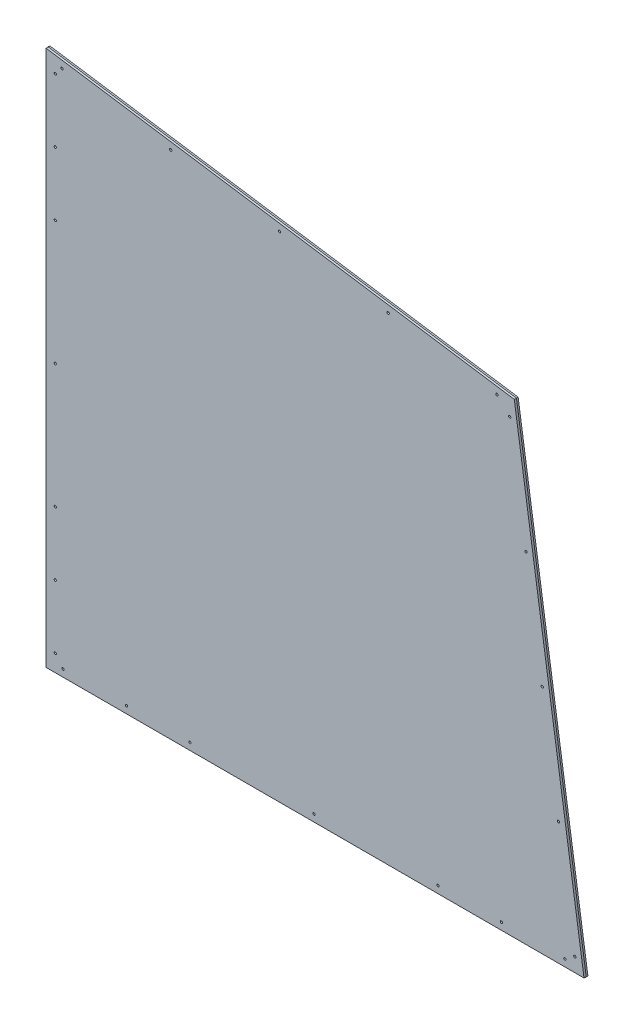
SolidWorks part; units mm, degrees
ref_plane "Front Plane" through (0, 0, 0) normal (0, 0, 1) x (1, 0, 0)
ref_plane "Top Plane" through (0, 0, 0) normal (0, 1, 0) x (1, 0, 0)
ref_plane "Right Plane" through (0, 0, 0) normal (1, 0, 0) x (0, 0, -1)
sketch "Sketch2" plane through (0, 0, 0) normal (0, 0, 1) x (1, 0, 0)
  line L0 (0, 4.3656) -> (0, 1212.85) construction
  line L1 (0, 1212.85) -> (1055.0672, 1055.0672) construction
  line L2 (1212.1971, 4.3656) -> (1055.0672, 1055.0672) construction
  line L3 (0, 4.3656) -> (1212.1971, 4.3656) construction
  line L4 (0, 4.3656) -> (0, 1212.85)
  line L5 (0, 1212.85) -> (1055.0672, 1055.0672)
  line L6 (1212.1971, 4.3656) -> (1055.0672, 1055.0672)
  line L7 (0, 4.3656) -> (1212.1971, 4.3656)
extrude "Boss-Extrude1" add sketch "Sketch2" along normal mid plane 8.7312
sketch "Sketch3" plane through (0, 0, 0) normal (-1, 0, 0) x (0, 0, 1)
  line L0 (0, 1212.85) -> (4.3656, 1212.1971)
  line L1 (4.3656, 1212.85) -> (-4.3656, 1212.85) construction
  line L2 (0, 1212.85) -> (-4.3656, 1212.1971)
  line L3 (-4.3656, 1212.1971) -> (-4.3656, 1215.39)
  line L4 (4.3656, 1212.1971) -> (4.3656, 1215.39)
  line L5 (4.3656, 1215.39) -> (-4.3656, 1215.39)
  line L6 (4.3656, 1212.85) -> (4.3656, 4.3656) construction
  line L7 (-4.3656, 1212.85) -> (-4.3656, 4.3656) construction
  line L8 (4.3656, 1212.1971) -> (1055.0672, 1055.0672) construction
  dimension "D1" = 2.54
  dimension "D2" = 8.505
extrude "Cut-Extrude1" cut sketch "Sketch3" along direction (-0.989, 0.1479, 0) on the side against the normal through all
sketch "Sketch4" plane through (0, 4.3656, 0) normal (0, -1, 0) x (1, 0, 0)
  line L0 (1212.1971, 0) -> (1211.5443, 4.3656)
  line L1 (1212.1971, 4.3656) -> (1212.1971, -4.3656) construction
  line L2 (1212.1971, 0) -> (1211.5443, -4.3656)
  line L3 (1211.5443, 4.3656) -> (1214.7371, 4.3656)
  line L4 (1211.5443, -4.3656) -> (1214.7371, -4.3656)
  line L5 (1214.7371, -4.3656) -> (1214.7371, 4.3656)
  line L6 (0, 4.3656) -> (1212.1971, 4.3656) construction
  line L7 (0, -4.3656) -> (1212.1971, -4.3656) construction
  line L8 (1212.85, 0) -> (1055.0672, 1055.0672) construction
  dimension "D1" = 2.54
  dimension "D2" = 8.505
extrude "Cut-Extrude2" cut sketch "Sketch4" along direction (-0.1479, 0.989, 0) on the side against the normal through all
sketch "Sketch5" plane through (0, 0, 4.3656) normal (0, 0, 1) x (1, 0, 0)
  line L0 (0, 20.2406) -> (38.1, 20.2406) construction
  line L1 (0, 1212.1971) -> (0, 4.3656) construction
  line L2 (20.6375, 4.3656) -> (20.6375, 42.4656) construction
  line L3 (0, 4.3656) -> (1211.5443, 4.3656) construction
  line L4 (38.1, 20.2406) -> (180.975, 20.2406) construction
  line L5 (20.6375, 42.4656) -> (20.6375, 185.3406) construction
  line L6 (20.6375, 185.3406) -> (20.6375, 328.2156) construction
  line L7 (180.975, 20.2406) -> (323.85, 20.2406) construction
  line L8 (323.85, 20.2406) -> (603.25, 20.2406) construction
  line L9 (603.25, 20.2406) -> (882.65, 20.2406) construction
  line L10 (20.6375, 328.2156) -> (20.6375, 607.6156) construction
  line L11 (20.6375, 607.6156) -> (20.6375, 887.0156) construction
  line L12 (20.6375, 887.0156) -> (20.6375, 1029.8906) construction
  line L13 (20.6375, 1029.8906) -> (20.6375, 1172.7656) construction
  line L14 (20.6375, 1172.7656) -> (20.6375, 1209.1108) construction
  line L15 (0, 1212.1971) -> (1054.4993, 1054.4993) construction
  line L16 (882.65, 20.2406) -> (1025.525, 20.2406) construction
  line L17 (1025.525, 20.2406) -> (1168.4, 20.2406) construction
  line L18 (1168.4, 20.2406) -> (1209.1702, 20.2406) construction
  line L19 (1054.4993, 1054.4993) -> (1211.5443, 4.3656) construction
  line L20 (-2.3555, 1196.4462) -> (35.6765, 1190.7586) construction
  line L21 (35.6765, 1190.7586) -> (280.6029, 1154.1304) construction
  line L22 (280.6029, 1154.1304) -> (525.5292, 1117.5023) construction
  line L23 (525.5292, 1117.5023) -> (770.4555, 1080.8741) construction
  line L24 (770.4555, 1080.8741) -> (525.5292, 1117.5023) construction
  line L25 (770.4555, 1080.8741) -> (1015.3818, 1044.246) construction
  line L26 (1015.3818, 1044.246) -> (1056.9626, 1038.0277) construction
  line L27 (1196.4462, -2.3555) -> (1190.7586, 35.6765) construction
  line L28 (1190.7586, 35.6765) -> (1154.1304, 280.6029) construction
  line L29 (1154.1304, 280.6029) -> (1117.5023, 525.5292) construction
  line L30 (1117.5023, 525.5292) -> (1080.8741, 770.4555) construction
  line L31 (1080.8741, 770.4555) -> (1044.246, 1015.3818) construction
  line L32 (1044.246, 1015.3818) -> (1038.0277, 1056.9626) construction
  line L35 (678.6742, 0) -> (-678.6742, 0) construction
  line L37 (1212.1971, 0) -> (1206.5095, 38.0321) construction
  line L39 (1206.5095, 38.0321) -> (1190.7586, 35.6765) construction
  line L40 (1196.4462, -2.3555) -> (1212.1971, 0) construction
  line L41 (38.0321, 1206.5095) -> (0, 1212.1971) construction
  line L42 (0, -680.2423) -> (0, 680.2423) construction
  line L43 (38.0321, 1206.5095) -> (35.6765, 1190.7586) construction
  line L44 (-2.3555, 1196.4462) -> (0, 1212.1971) construction
  circle A0 centre (525.5292, 1117.5023) radius 2.5794
  circle A1 centre (770.4555, 1080.8741) radius 2.5794
  circle A2 centre (1015.3818, 1044.246) radius 2.5794
  circle A3 centre (1044.246, 1015.3818) radius 2.5794
  circle A4 centre (1080.8741, 770.4555) radius 2.5794
  circle A5 centre (1117.5023, 525.5292) radius 2.5794
  circle A6 centre (1154.1304, 280.6029) radius 2.5794
  circle A7 centre (1190.7586, 35.6765) radius 2.5794
  circle A8 centre (1168.4, 20.2406) radius 2.5794
  circle A9 centre (1025.525, 20.2406) radius 2.5794
  circle A10 centre (882.65, 20.2406) radius 2.5794
  circle A11 centre (603.25, 20.2406) radius 2.5794
  circle A12 centre (323.85, 20.2406) radius 2.5794
  circle A13 centre (180.975, 20.2406) radius 2.5794
  circle A14 centre (38.1, 20.2406) radius 2.5794
  circle A15 centre (20.6375, 42.4656) radius 2.5794
  circle A16 centre (20.6375, 185.3406) radius 2.5794
  circle A17 centre (20.6375, 328.2156) radius 2.5794
  circle A18 centre (20.6375, 607.6156) radius 2.5794
  circle A19 centre (20.6375, 887.0156) radius 2.5794
  circle A20 centre (20.6375, 1029.8906) radius 2.5794
  circle A21 centre (20.6375, 1172.7656) radius 2.5794
  circle A22 centre (35.6765, 1190.7586) radius 2.5794
  circle A23 centre (280.6029, 1154.1304) radius 2.5794
  circle A25 centre (1190.7586, 35.6765) radius 2.5527 construction
  circle A26 centre (35.6765, 1190.7586) radius 2.5527 construction
  dimension "D27" = 5.1587
  dimension "D1" = 20.6375
  dimension "D2" = 15.875
  dimension "D3" = 38.1
  dimension "D4" = 38.1
  dimension "D5" = 142.875
  dimension "D6" = 142.875
  dimension "D7" = 142.875
  dimension "D8" = 142.875
  dimension "D9" = 279.4
  dimension "D10" = 279.4
  dimension "D11" = 279.4
  dimension "D12" = 279.4
  dimension "D13" = 142.875
  dimension "D14" = 142.875
  dimension "D15" = 36.3452
  dimension "D16" = 142.875
  dimension "D17" = 142.875
  dimension "D18" = 40.7702
  dimension "D21" = 247.65
  dimension "D24" = 247.65
  dimension "D25" = 42.0431
  dimension "D26" = 42.0431
extrude "Cut-Extrude3" cut sketch "Sketch5" against normal through all
sketch "Sketch6" plane through (0, 0, 4.3656) normal (0, 0, 1) x (1, 0, 0)
  line L0 (203.2, 4.3656) -> (203.2, 779.0656)
  line L1 (304.8, 880.6656) -> (788.1531, 880.6656)
  line L2 (888.6357, 794.0926) -> (1006.7375, 4.3656)
  line L3 (1006.7375, 4.3656) -> (203.2, 4.3656)
  line L4 (0, 4.3656) -> (1211.5443, 4.3656) construction
  line L5 (1055.0672, 1055.0672) -> (1212.1971, 4.3656) construction
  line L7 (0, 4.3656) -> (1211.5443, 4.3656) construction
  arc A0 (203.2, 779.0656) -> (304.8, 880.6656) centre (304.8, 779.0656) cw
  arc A1 (788.1531, 880.6656) -> (888.6357, 794.0926) centre (788.1531, 779.0656) cw
  dimension "D4" = 101.6
  dimension "D1" = 203.2
  dimension "D2" = 203.2
  dimension "D3" = 876.3
sketch "Sketch9" plane through (0, 0, 0) normal (0, 0, 1) x (1, 0, 0)
  line L0 (0, 4.3656) -> (1211.5443, 4.3656) construction
  line L1 (203.2, 4.3656) -> (1006.7375, 4.3656)
  line L2 (203.2, 4.3656) -> (203.2, 782.031)
  line L3 (319.8269, 882.5136) -> (813.7836, 808.6436)
  line L4 (1006.7375, 4.3656) -> (899.2393, 723.1879)
  line L6 (1055.0672, 1055.0672) -> (0, 1212.85) construction
  line L7 (1055.0672, 1055.0672) -> (1212.1971, 4.3656) construction
  arc A0 (813.7836, 808.6436) -> (899.2393, 723.1879) centre (798.7567, 708.161) cw
  arc A1 (203.2, 782.031) -> (319.8269, 882.5136) centre (304.8, 782.031) cw
  dimension "D1" = 101.6
  dimension "D2" = 203.2
  dimension "D3" = 279.4
  dimension "D4" = 203.2
sketch "Sketch7" [suppressed] plane through (0, 0, 4.3656) normal (0, 0, 1) x (1, 0, 0)
  line L4 (319.8269, 882.5136) -> (813.7836, 808.6436)
  line L5 (899.2393, 723.1879) -> (1006.7375, 4.3656)
  line L6 (1006.7375, 4.3656) -> (203.2, 4.3656)
  line L7 (203.2, 4.3656) -> (203.2, 782.031)
  line L8 (1006.7375, 4.3656) -> (899.2393, 723.1879) construction
  line L9 (319.8269, 882.5136) -> (813.7836, 808.6436) construction
  line L10 (203.2, 4.3656) -> (203.2, 782.031) construction
  arc A2 (899.2393, 723.1879) -> (813.7836, 808.6436) centre (798.7567, 708.161) ccw
  arc A3 (319.8269, 882.5136) -> (203.2, 782.031) centre (304.8, 782.031) ccw
  arc A4 (319.8269, 882.5136) -> (203.2, 782.031) centre (304.8, 782.031) ccw construction
  arc A6 (899.2393, 723.1879) -> (813.7836, 808.6436) centre (798.7567, 708.161) ccw construction
extrude "Cut-Extrude4" [suppressed] cut sketch "Sketch7" against normal through all
sketch "Sketch8" [suppressed] plane through (0, 0, 4.3656) normal (0, 0, 1) x (1, 0, 0)
  line L3 (203.2, 309.1656) -> (203.2, 782.031)
  line L4 (319.8269, 882.5136) -> (813.7836, 808.6436)
  line L5 (899.2393, 723.1879) -> (958.9081, 324.1926)
  line L6 (304.8, 207.5656) -> (858.4255, 207.5656)
  line L7 (0, 4.3656) -> (1211.5443, 4.3656) construction
  line L8 (203.2, 4.3656) -> (203.2, 782.031) construction
  line L9 (319.8269, 882.5136) -> (813.7836, 808.6436) construction
  line L10 (1006.7375, 4.3656) -> (899.2393, 723.1879) construction
  arc A2 (319.8269, 882.5136) -> (203.2, 782.031) centre (304.8, 782.031) ccw
  arc A3 (899.2393, 723.1879) -> (813.7836, 808.6436) centre (798.7567, 708.161) ccw
  arc A4 (203.2, 309.1656) -> (304.8, 207.5656) centre (304.8, 309.1656) ccw
  arc A5 (958.9081, 324.1926) -> (858.4255, 207.5656) centre (858.4255, 309.1656) cw
  arc A6 (319.8269, 882.5136) -> (203.2, 782.031) centre (304.8, 782.031) ccw construction
  arc A7 (899.2393, 723.1879) -> (813.7836, 808.6436) centre (798.7567, 708.161) ccw construction
  dimension "D1" = 203.2
extrude "Cut-Extrude5" [suppressed] cut sketch "Sketch8" against normal through all
sketch "Sketch10" [suppressed] plane through (0, 0, 0) normal (0, 0, 1) x (1, 0, 0)
  line L0 (304.8, 880.6656) -> (788.1531, 880.6656) construction
  line L1 (888.6357, 794.0926) -> (1006.7375, 4.3656) construction
  line L3 (203.2, 4.3656) -> (203.2, 779.0656) construction
  line L4 (304.8, 880.6656) -> (788.1531, 880.6656)
  line L5 (888.6357, 794.0926) -> (958.9081, 324.1926)
  line L6 (858.4255, 207.5656) -> (304.8, 207.5656)
  line L7 (203.2, 309.1656) -> (203.2, 779.0656)
  line L8 (1006.7375, 4.3656) -> (203.2, 4.3656) construction
  line L9 (0, 4.3656) -> (1211.5443, 4.3656) construction
  arc A0 (888.6357, 794.0926) -> (788.1531, 880.6656) centre (788.1531, 779.0656) ccw construction
  arc A1 (304.8, 880.6656) -> (203.2, 779.0656) centre (304.8, 779.0656) ccw construction
  arc A2 (888.6357, 794.0926) -> (788.1531, 880.6656) centre (788.1531, 779.0656) ccw
  arc A3 (304.8, 880.6656) -> (203.2, 779.0656) centre (304.8, 779.0656) ccw
  arc A4 (958.9081, 324.1926) -> (858.4255, 207.5656) centre (858.4255, 309.1656) cw
  arc A5 (304.8, 207.5656) -> (203.2, 309.1656) centre (304.8, 309.1656) cw
  point P16 (976.3494, 207.5656)
  point P19 (203.2, 207.5656)
  dimension "D2" = 101.6
  dimension "D1" = 203.2
extrude "Cut-Extrude6" [suppressed] cut sketch "Sketch10" against normal through all
sketch "Sketch11" [suppressed] plane through (0, 0, 4.3656) normal (0, 0, 1) x (1, 0, 0)
  line L0 (304.8, 880.6656) -> (788.1531, 880.6656) construction
  line L1 (888.6357, 794.0926) -> (1006.7375, 4.3656) construction
  line L2 (1006.7375, 4.3656) -> (203.2, 4.3656) construction
  line L3 (203.2, 4.3656) -> (203.2, 779.0656) construction
  line L4 (304.8, 880.6656) -> (788.1531, 880.6656)
  line L5 (888.6357, 794.0926) -> (1006.7375, 4.3656)
  line L6 (1006.7375, 4.3656) -> (203.2, 4.3656)
  line L7 (203.2, 4.3656) -> (203.2, 779.0656)
  arc A0 (888.6357, 794.0926) -> (788.1531, 880.6656) centre (788.1531, 779.0656) ccw construction
  arc A1 (304.8, 880.6656) -> (203.2, 779.0656) centre (304.8, 779.0656) ccw construction
  arc A2 (888.6357, 794.0926) -> (788.1531, 880.6656) centre (788.1531, 779.0656) ccw
  arc A3 (304.8, 880.6656) -> (203.2, 779.0656) centre (304.8, 779.0656) ccw
extrude "Cut-Extrude7" [suppressed] cut sketch "Sketch11" against normal through all
